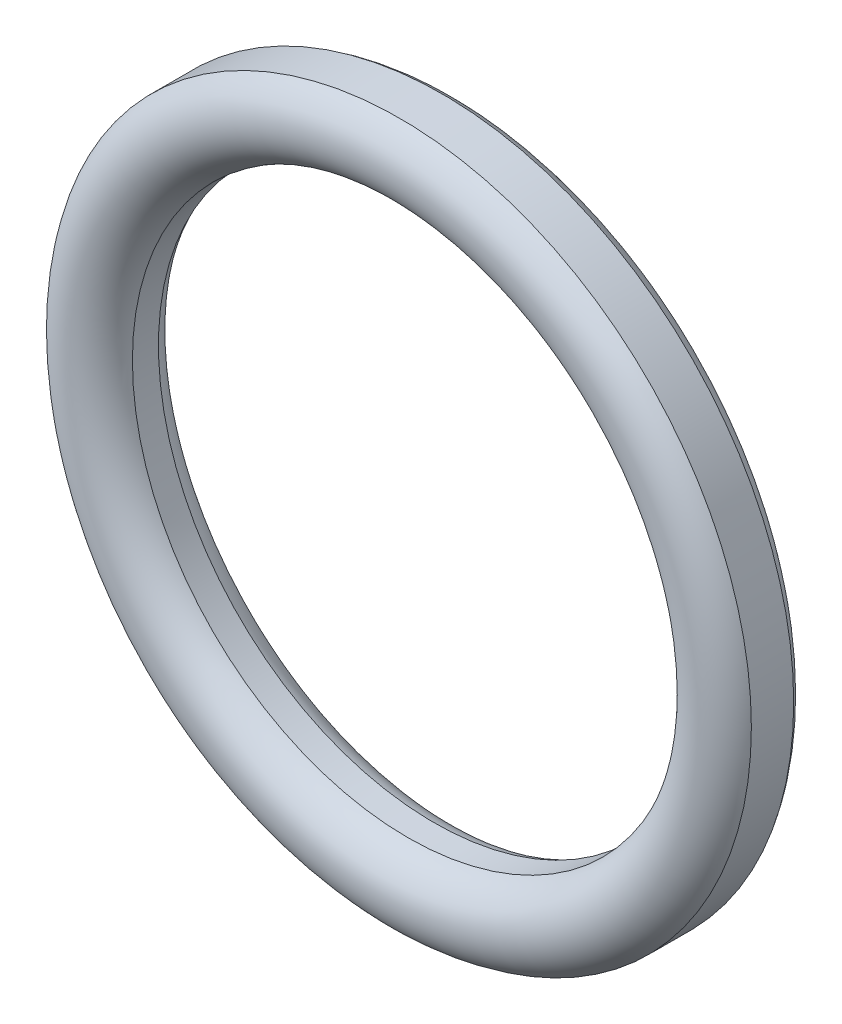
SolidWorks part; units mm, degrees
ref_plane "Front" through (0, 0, 0) normal (0, 0, 1) x (1, 0, 0)
ref_plane "Top" through (0, 0, 0) normal (0, 1, 0) x (1, 0, 0)
ref_plane "Right" through (0, 0, 0) normal (1, 0, 0) x (0, 0, -1)
sketch "Sketch1" plane through (0, 0, 0) normal (0, 0, 1) x (1, 0, 0)
  circle A0 centre (0, 0) radius 9.87
  dimension "D1" = 19.74
sketch "Sketch2" plane through (0, 0, 0) normal (1, 0, 0) x (0, 0, -1)
  line L0 (0, 9.87) -> (0, -9.87) construction
  line L1 (-1.31, 9.87) -> (1.31, 9.87) construction
  circle A0 centre (0, 9.87) radius 1.31
  dimension "D1" = 2.62
  dimension "D2" = 9.87
sweep "Base-Sweep" add profiles "Sketch2" path "Sketch1"
sketch "Sketch3" plane through (0, 0, 0) normal (0, 0, 1) x (1, 0, 0)
  circle A0 centre (0, 0) radius 8.625
  circle A1 centre (0, 0) radius 11
  dimension "D1" = 17.25
  dimension "D2" = 22
extrude "Cut-Extrude1" cut sketch "Sketch3" against normal through all and the other way through all flip side to cut
